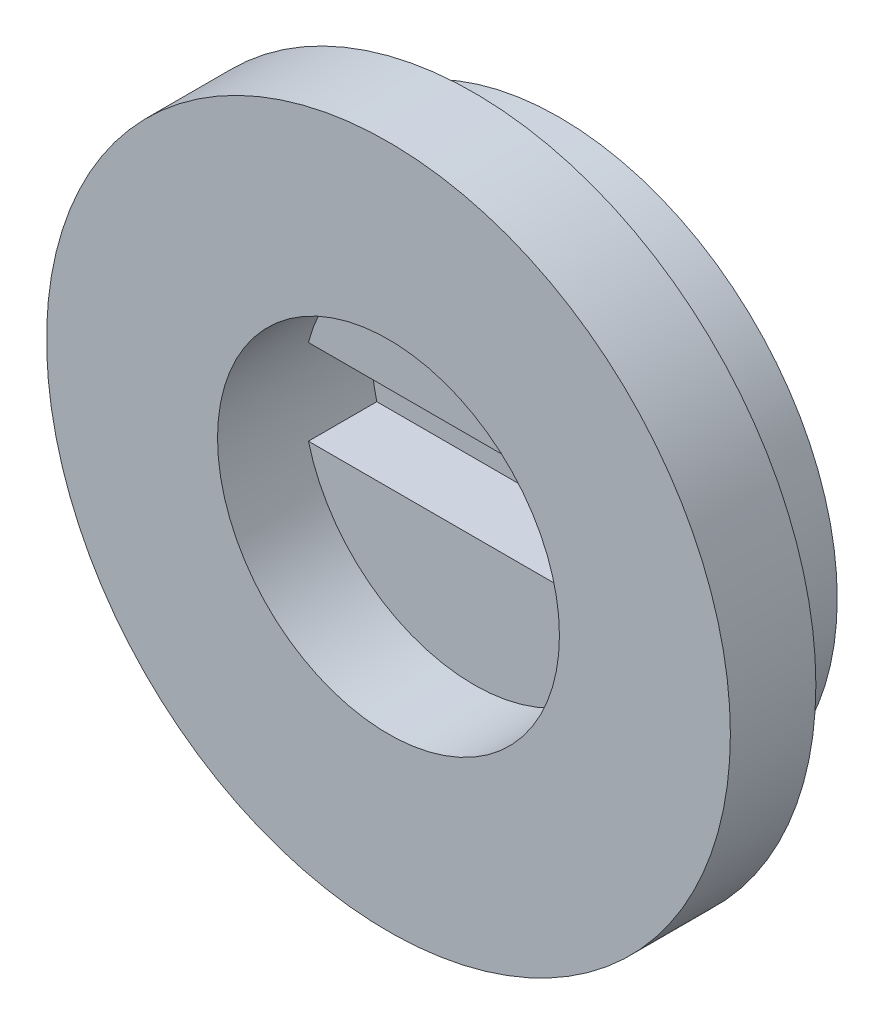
SolidWorks part; units mm, degrees
ref_plane "Plan de face" through (0, 0, 0) normal (0, 0, 1) x (1, 0, 0)
ref_plane "Plan de dessus" through (0, 0, 0) normal (0, 1, 0) x (1, 0, 0)
ref_plane "Plan de droite" through (0, 0, 0) normal (1, 0, 0) x (0, 0, -1)
sketch "Esquisse1" plane through (0, 0, 0) normal (0, 0, 1) x (1, 0, 0)
  circle A0 centre (-13, 3.9282) radius 3.25 construction
  circle A1 centre (-13, 3.9282) radius 3.25
extrude "Extrusion1" add sketch "Esquisse1" against normal blind 1
sketch "Esquisse2" plane through (0, 0, 0) normal (0, 0, 1) x (1, 0, 0)
  circle A0 centre (-13, 3.9282) radius 4 construction
  circle A1 centre (-13, 3.9282) radius 4
extrude "Extrusion2" add sketch "Esquisse2" along normal blind 1
sketch "Esquisse3" plane through (0, 0, 1) normal (0, 0, 1) x (1, 0, 0)
  circle A0 centre (-13, 3.9282) radius 2
  circle A1 centre (-13, 3.9282) radius 4 construction
  dimension "D1" = 4
extrude "Enlèv. mat.-Extru.1" cut sketch "Esquisse3" against normal blind 1
sketch "Esquisse4" plane through (0, 0, 0) normal (0, 0, 1) x (1, 0, 0)
  line L0 (-14.9365, 4.4282) -> (-11.0635, 4.4282)
  line L1 (-11.0635, 3.4282) -> (-14.9365, 3.4282)
  line L2 (-17.3204, 3.9282) -> (-8.5661, 3.9282) construction
  circle A0 centre (-13, 3.9282) radius 2 construction
  arc A1 (-11.0635, 3.4282) -> (-11.0635, 4.4282) centre (-13, 3.9282) ccw
  arc A2 (-14.9365, 4.4282) -> (-14.9365, 3.4282) centre (-13, 3.9282) ccw
  dimension "D1" = 1
extrude "Enlèv. mat.-Extru.2" cut sketch "Esquisse4" against normal blind 0.8
